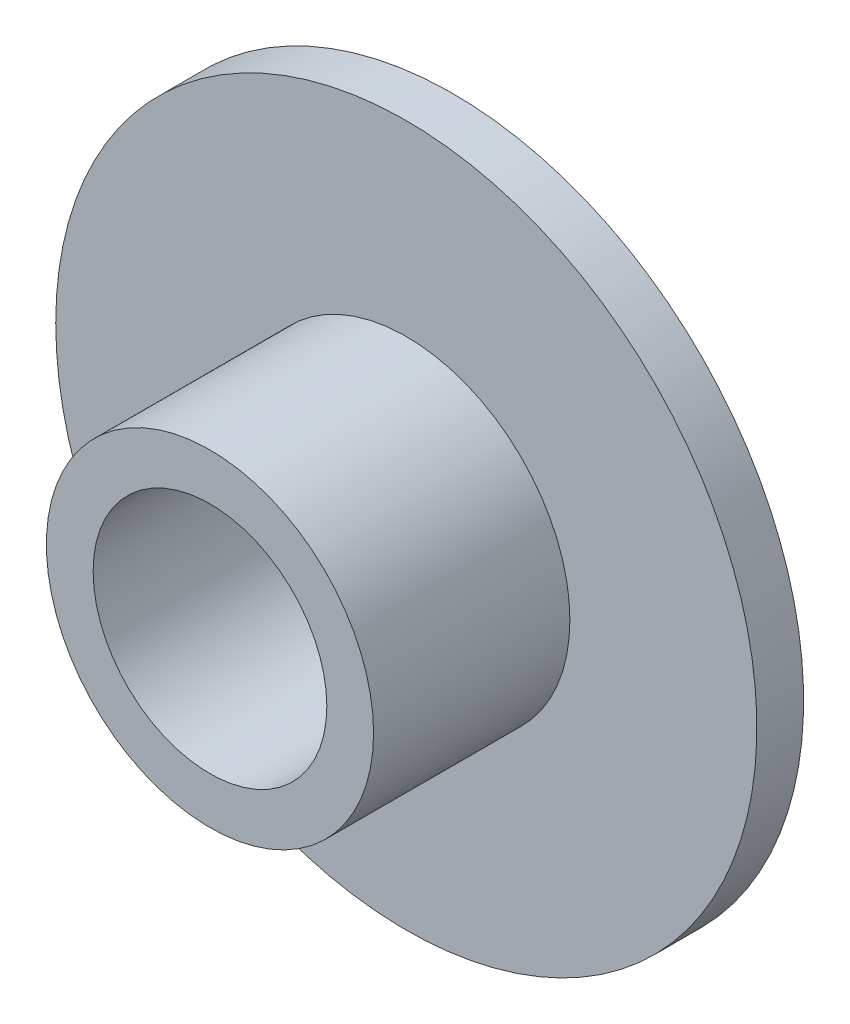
SolidWorks part; units mm, degrees
ref_plane "前基準面" through (0, 0, 0) normal (0, 0, 1) x (1, 0, 0)
ref_plane "上基準面" through (0, 0, 0) normal (0, 1, 0) x (1, 0, 0)
ref_plane "右基準面" through (0, 0, 0) normal (1, 0, 0) x (0, 0, -1)
sketch "草圖1" plane through (0, 0, 0) normal (0, 0, 1) x (1, 0, 0)
  circle A0 centre (0, 0) radius 2.5
  circle A1 centre (0, 0) radius 3.5
  dimension "D1" = 5
  dimension "D2" = 7
extrude "填料-伸長1" add sketch "草圖1" along normal blind 4.2
sketch "草圖2" plane through (0, 0, 0) normal (0, 0, -1) x (-1, 0, 0)
  circle A0 centre (0, 0) radius 7.5
  circle A1 centre (0, 0) radius 2.5 construction
  circle A2 centre (0, 0) radius 2.5
  dimension "D1" = 15
extrude "填料-伸長2" add sketch "草圖2" along normal blind 1
